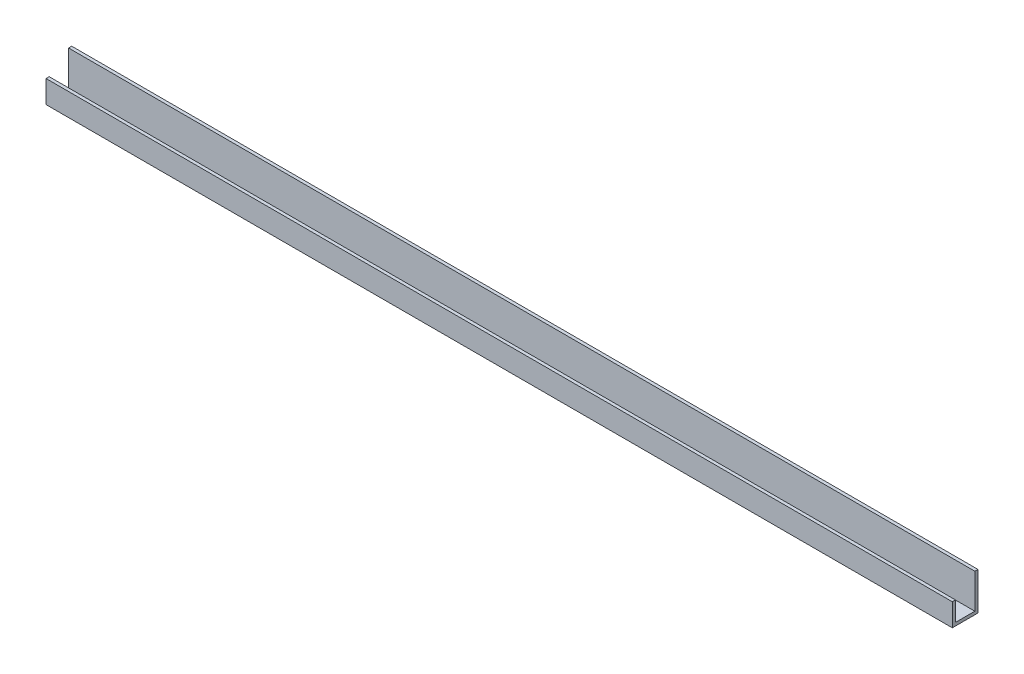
SolidWorks part; units mm, degrees
ref_plane "Front Plane" through (0, 0, 0) normal (0, 0, 1) x (1, 0, 0)
ref_plane "Top Plane" through (0, 0, 0) normal (0, 1, 0) x (1, 0, 0)
ref_plane "Right Plane" through (0, 0, 0) normal (1, 0, 0) x (0, 0, -1)
sketch "Sketch1" plane through (0, 0, 0) normal (0, 1, 0) x (1, 0, 0)
  line L1 (0, 0) -> (457.2, 0)
  line L2 (0, 0) -> (0, -12.954)
  line L3 (0, -12.954) -> (457.2, -12.954)
  line L4 (457.2, 0) -> (457.2, -12.954)
  dimension "D1" = 457.2
  dimension "D2" = 12.954
extrude "Boss-Extrude1" add sketch "Sketch1" along normal blind 19.05
sketch "Sketch2" plane through (0, 19.05, 0) normal (0, 1, 0) x (1, 0, 0)
  line L0 (0, 0) -> (0, -12.954) construction
  line L1 (0, -1.5875) -> (457.2, -1.5875)
  line L2 (0, -1.5875) -> (0, -11.3665)
  line L3 (0, -11.3665) -> (457.2, -11.3665)
  line L4 (457.2, -1.5875) -> (457.2, -11.3665)
  line L5 (457.2, -12.954) -> (457.2, 0) construction
  line L6 (457.2, 0) -> (0, 0) construction
  line L7 (0, -12.954) -> (457.2, -12.954) construction
  dimension "D1" = 1.5875
  dimension "D2" = 1.5875
extrude "Cut-Extrude1" cut sketch "Sketch2" against normal blind 17.4625
sketch "Sketch3" plane through (0, 0, 12.954) normal (0, 0, 1) x (1, 0, 0)
  line L0 (457.2, 19.05) -> (457.2, 0) construction
  line L1 (0, 19.05) -> (457.2, 19.05)
  line L2 (0, 19.05) -> (0, 11.4046)
  line L3 (0, 11.4046) -> (457.2, 11.4046)
  line L4 (457.2, 19.05) -> (457.2, 11.4046)
  dimension "D1" = 7.6454
extrude "Cut-Extrude2" cut sketch "Sketch3" against normal up to next
